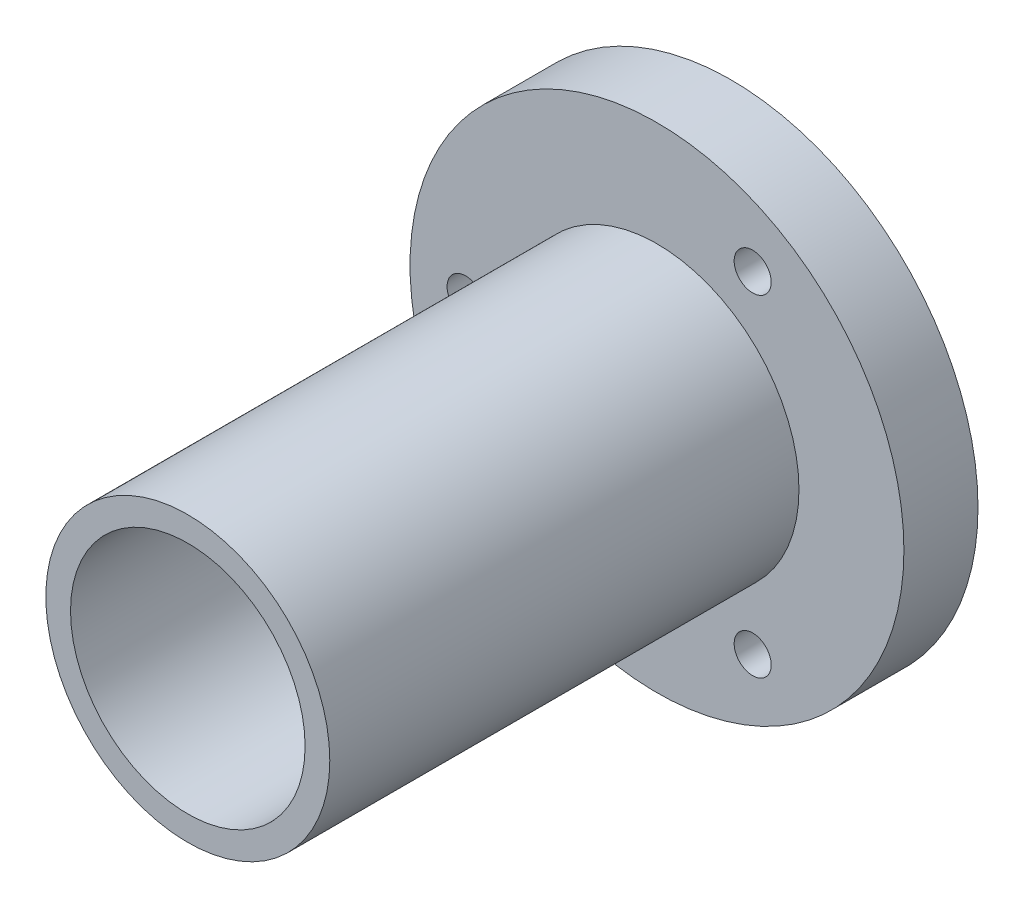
SolidWorks part; units mm, degrees
ref_plane "Front" through (0, 0, 0) normal (0, 0, 1) x (1, 0, 0)
ref_plane "Top" through (0, 0, 0) normal (0, 1, 0) x (1, 0, 0)
ref_plane "Right" through (0, 0, 0) normal (1, 0, 0) x (0, 0, -1)
sketch "Esquisse1" plane through (0, 0, 0) normal (0, 0, 1) x (1, 0, 0)
  circle A0 centre (0, 0) radius 20
  dimension "D1" = 40
extrude "Boss.-Extru.1" add sketch "Esquisse1" along normal blind 6
sketch "Esquisse2" plane through (0, 0, 6) normal (0, 0, 1) x (1, 0, 0)
  circle A0 centre (0, 0) radius 11.5
  dimension "D1" = 23
extrude "Boss.-Extru.2" add sketch "Esquisse2" along normal blind 38
hole_wizard "Diamètre du perçage Ø0.15 (0.15)1" positions "Esquisse4" profile "Esquisse3" hole size "Ø0.15" standard "Ansi Metric"
sketch "Esquisse4" plane through (0, 0, 0) normal (0, 0, -1) x (-1, 0, 0)
  point P0 (0, 0)
sketch "Esquisse3" plane through (0, 0, 0) normal (1, 0, 0) x (0, 1, 0)
  line L0 (0, 0) -> (0, 44)
  line L1 (0, 44) -> (9.5, 44)
  line L2 (9.5, 44) -> (9.5, 0)
  line L5 (9.5, 0) -> (0, 0)
  line L11 (0, -6.35) -> (0, 107.95) construction
  dimension "Diamètre du perçage jusqu'au prochain" = 19
  dimension "Profondeur du perçage jusqu'au prochain" = 44
hole_wizard "Diamètre du perçage Ø0.15 (0.15)2" positions "Esquisse6" profile "Esquisse5" hole size "Ø0.15" standard "Ansi Metric"
sketch "Esquisse6" plane through (0, 0, 0) normal (0, 0, -1) x (-1, 0, 0)
  point P0 (15.5, 0)
  dimension "D1" = 15.5
sketch "Esquisse5" plane through (-15.5, 0, 0) normal (1, 0, 0) x (0, 1, 0)
  line L0 (0, 0) -> (0, 6.001)
  line L1 (0, 6.001) -> (1.5, 6.001)
  line L2 (1.5, 6.001) -> (1.5, 0)
  line L5 (1.5, 0) -> (0, 0)
  line L11 (0, -6.35) -> (0, 107.95) construction
  dimension "Diamètre du perçage jusqu'au prochain" = 3
  dimension "Profondeur du perçage jusqu'au prochain" = 6.001
pattern_circular "Répétition circulaire1" count 3 over 360 about axis through (0, 0, 0) along (0, 0, 1) of "Diamètre du perçage Ø0.15 (0.15)2"
